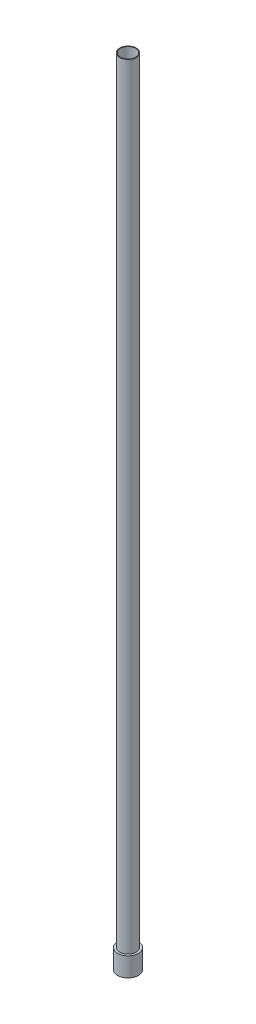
SolidWorks part; units mm, degrees
ref_plane "Front Plane" through (0, 0, 0) normal (0, 0, 1) x (1, 0, 0)
ref_plane "Top Plane" through (0, 0, 0) normal (0, 1, 0) x (1, 0, 0)
ref_plane "Right Plane" through (0, 0, 0) normal (1, 0, 0) x (0, 0, -1)
sketch "Sketch2" plane through (0, 0, 0) normal (0, 0, 1) x (1, 0, 0)
  line L0 (0, 0) -> (0, 304.8) construction
  line L1 (-2.921, 0) -> (-3.9624, 0)
  line L2 (-3.9624, 0) -> (-3.9624, 7.366)
  line L3 (-3.9624, 7.366) -> (-3.175, 7.366)
  line L4 (-3.175, 7.366) -> (-3.175, 304.8)
  line L5 (-3.175, 304.8) -> (-2.921, 304.8)
  line L6 (-2.921, 0) -> (-2.921, 304.8)
  dimension "D1" = 7.366
  dimension "D2" = 7.9248
  dimension "D3" = 6.35
  dimension "D4" = 304.8
  dimension "D5" = 5.842
revolve "Revolve1" add sketch "Sketch2" angle 360 about L0
